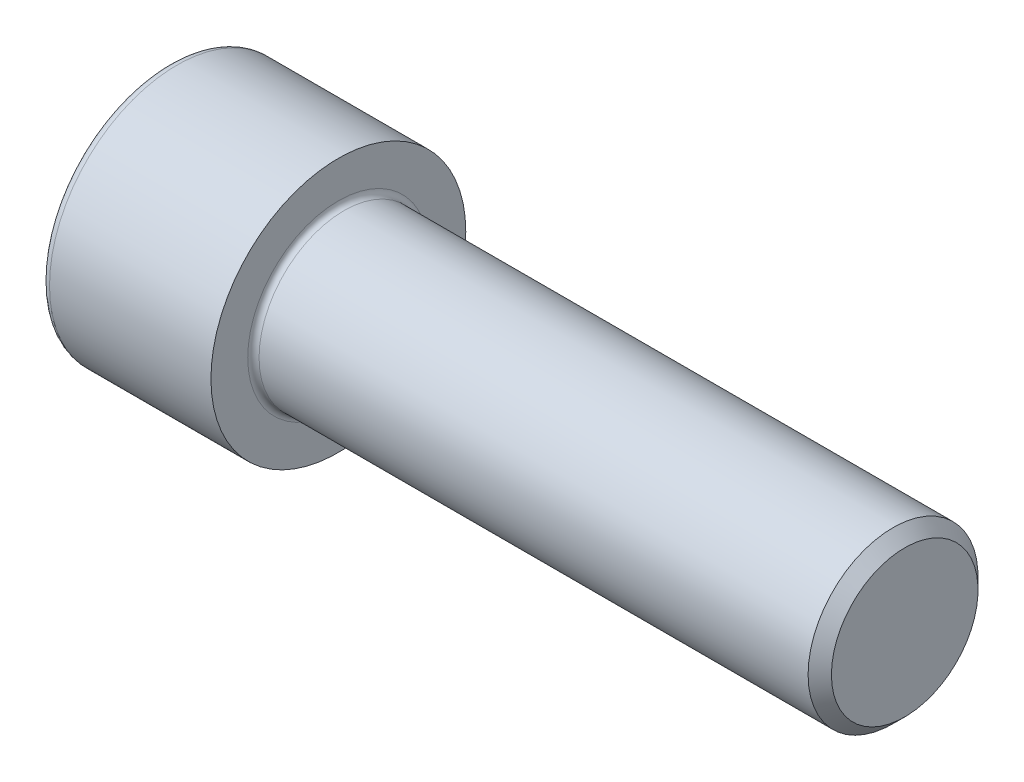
SolidWorks part; units mm, degrees
ref_plane "Plane1" through (0, 0, 0) normal (0, 0, 1) x (1, 0, 0)
ref_plane "Plane2" through (0, 0, 0) normal (0, 1, 0) x (1, 0, 0)
ref_plane "Plane3" through (0, 0, 0) normal (1, 0, 0) x (0, 0, -1)
sketch "BodySke" plane through (0, 0, 0) normal (0, 0, 1) x (1, 0, 0)
  line L0 (0, 0) -> (0, 18)
  line L1 (0, 18) -> (24, 18)
  line L2 (24, 18) -> (24, 12)
  line L3 (24, 12) -> (102.352, 12)
  line L4 (104, 10.352) -> (104, 0)
  line L5 (104, 0) -> (0, 0)
  line L6 (-31.75, 0) -> (127, 0) construction
  line L8 (104, 10.352) -> (102.352, 12)
  line L10 (104, -10.352) -> (102.352, -12) construction
  line L11 (27, 9.525) -> (27, 3.175) construction
  line L12 (44, 9.525) -> (44, 3.175) construction
  line L13 (44, 9.525) -> (44, 3.175) construction
  dimension "Diameter" = 24
  dimension "Head_ht" = 24
  dimension "Length" = 80
  dimension "Body_ch_ang" = 45
  dimension "Head_dia" = 36
  dimension "Minor_dia" = 20.704
  dimension "Advance" = 3
  dimension "Thread_nom" = 60
  dimension "Thread_length" = 60
revolve "Base-Revolve" add sketch "BodySke"
fillet "Fillet1" radius 0.8 1 edges at (24, 0, 12)
fillet "Fillet2" radius 1.2 1 edges at (0, 0, 18)
sketch "Sketch2" plane through (0, 0, 0) normal (0, 0, 1) x (1, 0, 0)
  line L0 (0, 9.6375) -> (12.573, 9.6375)
  line L1 (12.573, 9.6375) -> (18.1372, 0)
  line L2 (-31.75, 0) -> (127, 0) construction
  line L3 (18.1372, 0) -> (0, 0)
  line L4 (0, 0) -> (0, 9.6375)
  line L6 (0, 0) -> (47.625, 0) construction
  dimension "D1" = 9.6375
  dimension "D2" = 60
  dimension "Depth" = 12.573
revolve "Hex-PreBroach" cut sketch "Sketch2" angle 360 about L6
sketch "Sketch3" plane through (0, 0, 0) normal (-1, 0, 0) x (0, 0.5, 0.866)
  line L0 (5.5642, 9.6375) -> (-5.5642, 9.6375)
  line L1 (-5.5642, 9.6375) -> (-11.1284, 0)
  line L2 (5.5642, 9.6375) -> (11.1284, 0)
  line L3 (5.5642, -9.6375) -> (11.1284, 0)
  line L4 (5.5642, -9.6375) -> (-5.5642, -9.6375)
  line L5 (-5.5642, -9.6375) -> (-11.1284, 0)
  dimension "D1" = 9.6375
  dimension "D2" = 9.6375
  dimension "Hex_size" = 19.275
extrude "Hex" cut sketch "Sketch3" against normal blind 12.573
sketch "ThdSchSke" plane through (0, 0, 0) normal (0, 0, 1) x (1, 0, 0)
  line L0 (44, -10.352) -> (42.8461, -12)
  line L1 (44, -10.352) -> (45.1539, -12)
  line L2 (45.1539, -12) -> (45.1539, -15)
  line L3 (-3.175, 0) -> (5.1513, 0) construction
  line L4 (0, 16.8) -> (0, -16.8) construction
  line L5 (45.1539, -15) -> (42.8461, -15)
  line L6 (42.8461, -15) -> (42.8461, -12)
  dimension "Thread_minor" = 20.704
  dimension "Diameter" = 24
  dimension "Start" = 44
  dimension "SideAngle" = 55
  dimension "VeeAngle" = 70
  dimension "Overcut" = 30
revolve "ThreadSchematic" [suppressed] cut sketch "ThdSchSke" angle 360 about L3
pattern_linear "ThdSchPat" [suppressed]
equation "\"D2@Sketch3\" = \"Hex_size@Sketch3\" / 2"
equation "\"D1@Sketch3\" = \"Hex_size@Sketch3\" / 2"
equation "\"D1@Sketch2\" = \"Hex_size@Sketch3\" / 2"
equation "\"Thread_minor@ThreadCosmetic\"  =  \"Minor_dia@BodySke\""
equation "\"Depth@Sketch2\" =  \"Key_eng@Hex\""
equation "\"Thread_length@ThreadCosmetic\" = ((sgn( (\"Length@BodySke\" - \"Advance@BodySke\" * 3.0) - \"Thread_nom@BodySke\" )-1)*( (\"Length@BodySke\" - \"Advance@BodySke\" * 3.0) - \"Thread_nom@BodySke\" ))/-2+ \"Thread_no"
equation "\"Thread_minor@ThdSchSke\" = \"Minor_dia@BodySke\""
equation "\"Diameter@ThdSchSke\" = \"Diameter@BodySke\""
equation "\"Overcut@ThdSchSke\" = \"Diameter@BodySke\" * 1.25"
equation "\"Start@ThdSchSke\" = \"Head_ht@BodySke\" + \"Length@BodySke\" - \"Thread_length@ThreadCosmetic\"  '---Non-countersunk---"
equation "\"Num_threads@ThdSchPat\" = int( \"Thread_length@ThreadCosmetic\" / \"Advance@BodySke\" + 0.999 )  + 1"
equation "\"Advance@ThdSchPat\" = \"Thread_length@ThreadCosmetic\" /  (\"Num_threads@ThdSchPat\" - 1) 'relax it"
equation "\"Num_threads@ThdSchPat\" = \"Num_threads@ThdSchPat\" - sgn( \"Num_threads@ThdSchPat\" - 1) '---chamfered tips only---"
